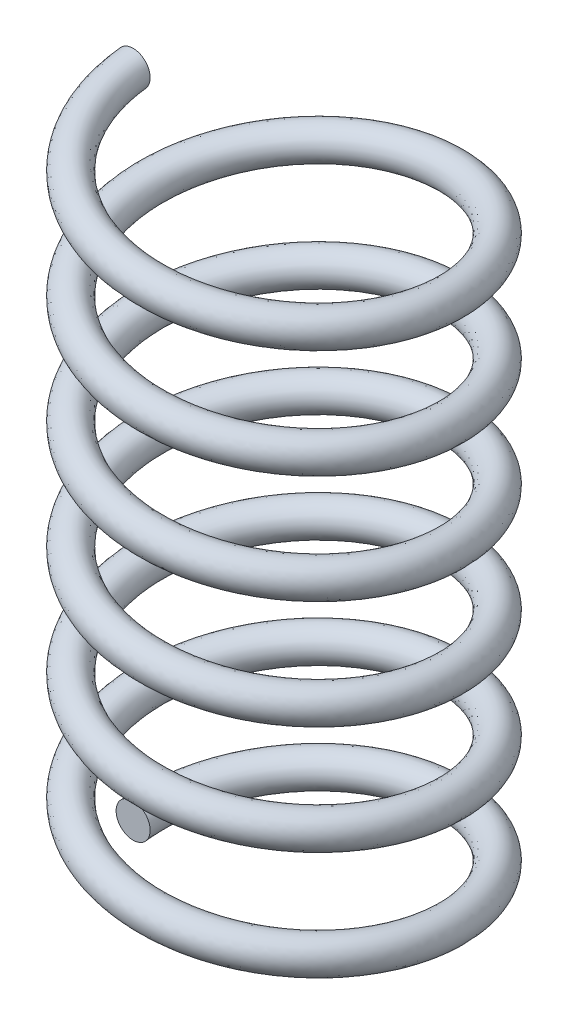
SolidWorks part; units mm, degrees
ref_plane "前视基准面" through (0, 0, 0) normal (0, 0, 1) x (1, 0, 0)
ref_plane "上视基准面" through (0, 0, 0) normal (0, 1, 0) x (1, 0, 0)
ref_plane "右视基准面" through (0, 0, 0) normal (1, 0, 0) x (0, 0, -1)
sketch "草图2" plane through (0, 0, 0) normal (0, 1, 0) x (1, 0, 0)
  circle A0 centre (0, 0) radius 25
  dimension "D1" = 50
curve "螺旋线/涡状线1"
sketch "草图3" plane through (0, 0, 0) normal (0, 0, 1) x (1, 0, 0)
  circle A0 centre (-25, 0) radius 2.821
  spline S0 degree 3 number of poles 136 (-25, 0) -> (-25, 108) construction
sweep "扫描4" add profiles "草图3" path "螺旋线/涡状线1"
